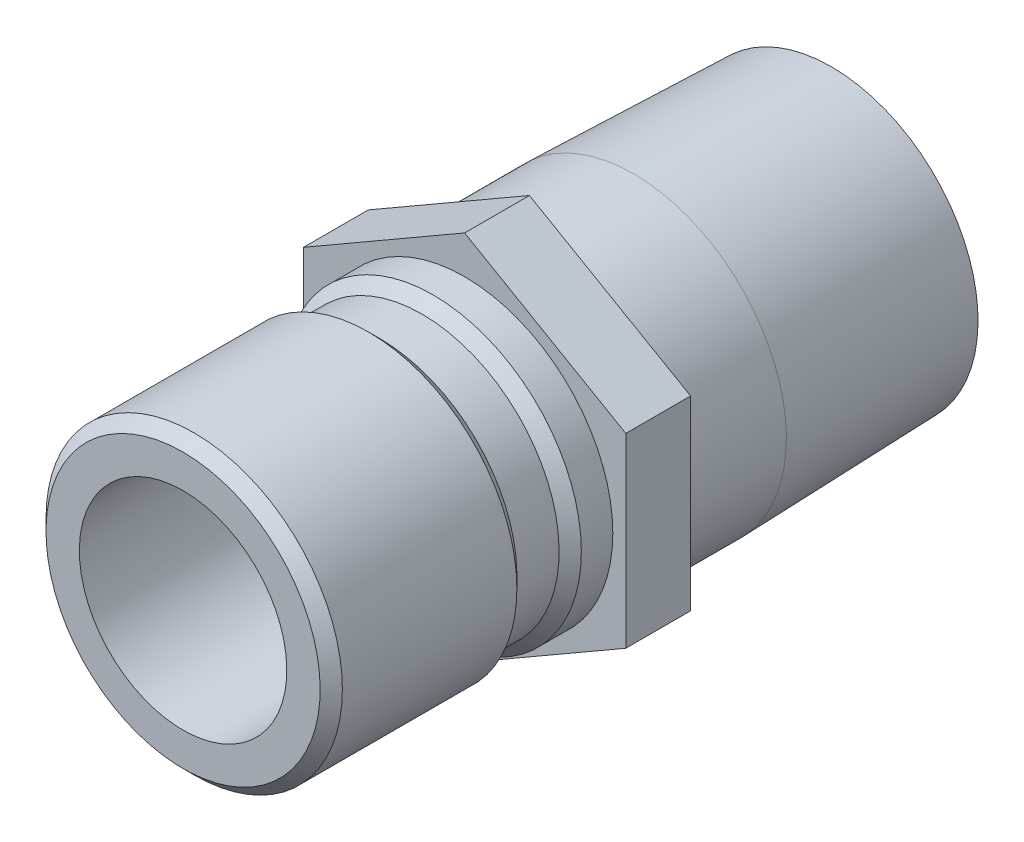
SolidWorks part; units mm, degrees
ref_plane "Front Plane" through (0, 0, 0) normal (0, 0, 1) x (1, 0, 0)
ref_plane "Top Plane" through (0, 0, 0) normal (0, 1, 0) x (1, 0, 0)
ref_plane "Right Plane" through (0, 0, 0) normal (1, 0, 0) x (0, 0, -1)
sketch "Sketch1" plane through (0, 0, 0) normal (1, 0, 0) x (0, 0, -1)
  line L0 (0, 0) -> (-22.479, 0) construction
  line L1 (-19.304, 7.112) -> (-19.304, 9.398)
  line L2 (-5.8166, 9.398) -> (-5.8166, 0) construction
  line L3 (-18.542, 10.16) -> (-6.5786, 10.16)
  line L4 (0, 10.4775) -> (0, 0) construction
  line L5 (-5.8166, 9.398) -> (-2.921, 9.398)
  line L6 (-2.159, 10.16) -> (0, 10.16)
  line L7 (0, 10.16) -> (0, 10.4775)
  line L8 (-5.8166, 9.398) -> (-6.5786, 10.16)
  line L9 (-2.921, 9.398) -> (-2.159, 10.16)
  line L10 (-19.304, 9.398) -> (-18.542, 10.16)
  line L11 (-1.1053, 7.8994) -> (25.146, 7.8994)
  line L12 (0, 10.4775) -> (11.5824, 10.4775)
  line L13 (11.5824, 10.4775) -> (25.146, 10.0536)
  line L14 (25.146, 10.0536) -> (25.146, 7.8994)
  line L15 (4.445, 0) -> (0, 0) construction
  line L16 (-19.304, 7.112) -> (-1.524, 7.112)
  line L17 (-1.524, 7.112) -> (-1.1053, 7.8994)
  dimension "D1" = 19.304
  dimension "D2" = 2.8956
  dimension "D3" = 0.762
  dimension "D4" = 45
  dimension "D5" = 13.4874
  dimension "D6" = 45
  dimension "D7" = 1.79
  dimension "D8" = 13.5636
  dimension "D9" = 44.45
  dimension "D10" = 3.175
  dimension "D11" = 4.445
  dimension "D12" = 15.7988
  dimension "D13" = 20.955
  dimension "D14" = 20.32
  dimension "D15" = 118
  dimension "D16" = 14.224
  dimension "D17" = 17.78
revolve "Revolve1" add sketch "Sketch1" angle 360 about L0
sketch "Sketch2" plane through (0, 0, 0) normal (0, 0, 1) x (1, 0, 0)
  line L1 (-11.049, 6.3791) -> (-11.049, -6.3791)
  line L2 (-11.049, -6.3791) -> (0, -12.7583)
  line L3 (0, -12.7583) -> (11.049, -6.3791)
  line L4 (11.049, -6.3791) -> (11.049, 6.3791)
  line L5 (11.049, 6.3791) -> (0, 12.7583)
  line L6 (0, 12.7583) -> (-11.049, 6.3791)
  circle A0 centre (0, 0) radius 11.049 construction
  circle A1 centre (0, 0) radius 7.8994 construction
  circle A2 centre (0, 0) radius 7.8994
  dimension "D1" = 22.098
extrude "Boss-Extrude1" add sketch "Sketch2" against normal up to vertex (4.445 mm away)
